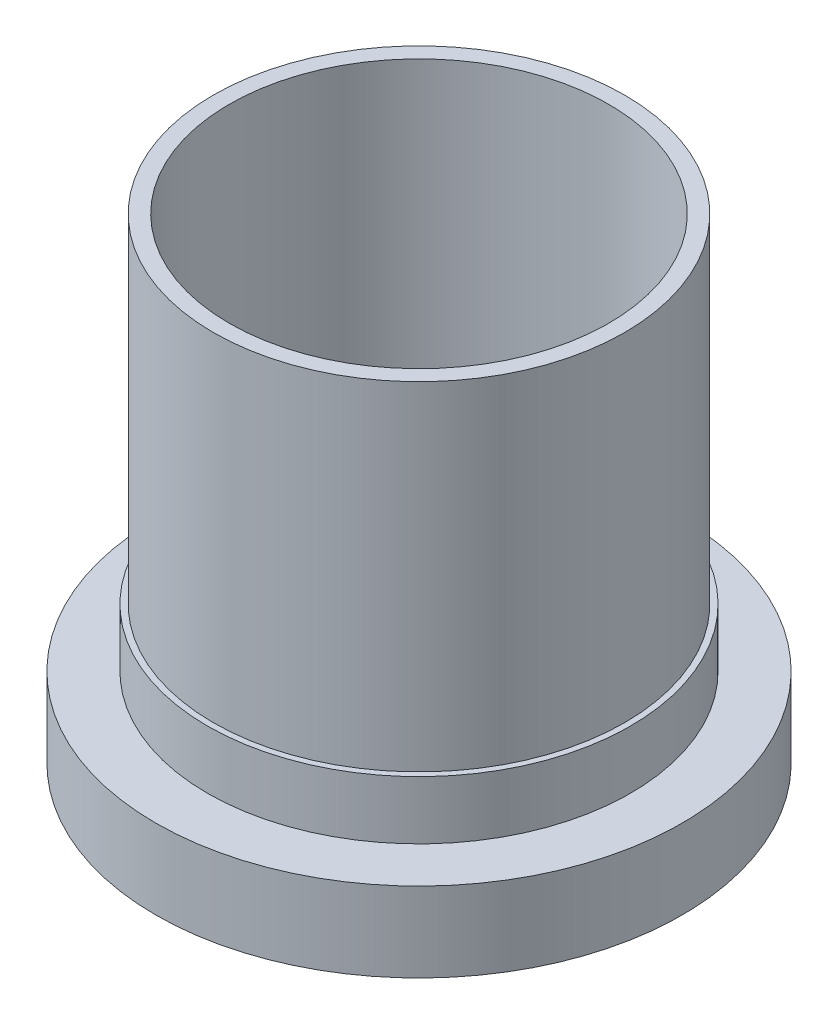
SolidWorks part; units mm, degrees
ref_plane "Plan de face" through (0, 0, 0) normal (0, 0, 1) x (1, 0, 0)
ref_plane "Plan de dessus" through (0, 0, 0) normal (0, 1, 0) x (1, 0, 0)
ref_plane "Plan de droite" through (0, 0, 0) normal (1, 0, 0) x (0, 0, -1)
sketch "Esquisse1" plane through (0, 0, 0) normal (0, 0, 1) x (1, 0, 0)
  line L0 (-119.8523, 152.1268) -> (-119.8523, 54.6123)
  line L1 (-109.0023, 39.6268) -> (-109.0023, 29.6268)
  line L2 (-115.7893, 45.6121) -> (-109.0023, 39.6268)
  line L4 (-123.9523, 152.1268) -> (-119.8523, 152.1268)
  line L8 (-123.9523, 65.1268) -> (-123.9523, 152.1268)
  line L9 (-125.4523, 50.1268) -> (-125.4523, 65.1268)
  line L11 (-138.7523, 50.1268) -> (-125.4523, 50.1268)
  line L12 (-138.7523, 29.6268) -> (-138.7523, 50.1268)
  line L15 (-109.0023, 29.6268) -> (-138.7523, 29.6268)
  line L18 (-123.9523, 65.1268) -> (-125.4523, 65.1268)
  line L29 (-71.0023, 158.7367) -> (-71.0023, 21.124) construction
  arc A20 (-115.7893, 45.6121) -> (-119.8523, 54.6123) centre (-107.8523, 54.6123) cw
  dimension "D1" = 38
  dimension "D7" = 97.7
  dimension "D8" = 105.9
  dimension "D39" = 12
  dimension "D5" = 122.5
  dimension "D6" = 102
  dimension "D9" = 112.5
  dimension "D27" = 15
  dimension "D40" = 67.75
revolve "Révolution1" add sketch "Esquisse1" angle 360 about L29
